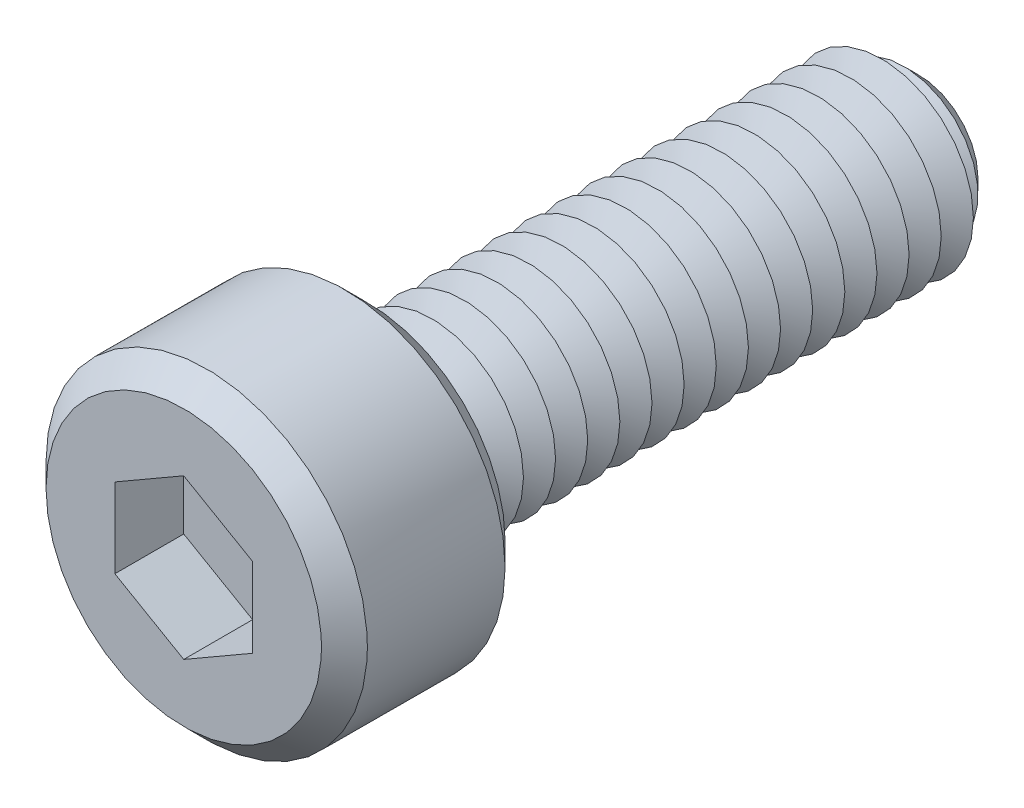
SolidWorks part; units mm, degrees
ref_plane "Front Plane" through (0, 0, 0) normal (0, 0, 1) x (1, 0, 0)
ref_plane "Top Plane" through (0, 0, 0) normal (0, 1, 0) x (1, 0, 0)
ref_plane "Right Plane" through (0, 0, 0) normal (1, 0, 0) x (0, 0, -1)
sketch "Sketch1" plane through (0, 0, 0) normal (0, 0, 1) x (1, 0, 0)
  circle A0 centre (0, 0) radius 3.5
  dimension "D1" = 7
extrude "Boss-Extrude1" add sketch "Sketch1" along normal blind 4
sketch "Sketch2" plane through (0, 0, 0) normal (0, 0, -1) x (-1, 0, 0)
  circle A0 centre (0, 0) radius 2
  dimension "D1" = 4
extrude "Boss-Extrude2" add sketch "Sketch2" along normal blind 12
chamfer "Chamfer1" distance 0.7 angle 45 1 edges at (-2, 0, -12)
sketch "Sketch3" plane through (0, 0, 0) normal (1, 0, 0) x (0, 0, -1)
  line L0 (-2.5121, 0) -> (4.5776, 0) construction
sketch "Sketch4" plane through (0, 0, 0) normal (1, 0, 0) x (0, 0, -1)
  line L0 (0, 2) -> (0.35, 1.3938)
  line L1 (0.35, 1.3938) -> (0.7, 2)
  line L2 (11.3, 2) -> (0, 2) construction
  line L3 (0.7, 2) -> (0, 2)
  dimension "D1" = 0.7
revolve "Cut-Revolve1" cut sketch "Sketch4" angle 360 about L0
pattern_linear "LPattern1" count 17 spacing 0.7 along (0, 0, -1) of "Cut-Revolve1"
sketch "Sketch5" plane through (0, 0, 4) normal (0, 0, 1) x (1, 0, 0)
  line L1 (0, 1.7321) -> (-1.5, 0.866)
  line L2 (-1.5, 0.866) -> (-1.5, -0.866)
  line L3 (-1.5, -0.866) -> (0, -1.7321)
  line L4 (0, -1.7321) -> (1.5, -0.866)
  line L5 (1.5, -0.866) -> (1.5, 0.866)
  line L6 (1.5, 0.866) -> (0, 1.7321)
  circle A0 centre (0, 0) radius 1.5 construction
  dimension "D1" = 3
extrude "Cut-Extrude1" cut sketch "Sketch5" against normal blind 1.5
sketch "Sketch6" plane through (0, 0, 2.5) normal (0, 0, 1) x (1, 0, 0)
  circle A0 centre (0, 0) radius 0.5
  dimension "D1" = 1
extrude "Cut-Extrude2" cut sketch "Sketch6" against normal up to surface (14.5 mm away)
chamfer "Chamfer2" distance 0.5 angle 45 2 edges at (3.5, 0, 0) (3.5, 0, 4)
